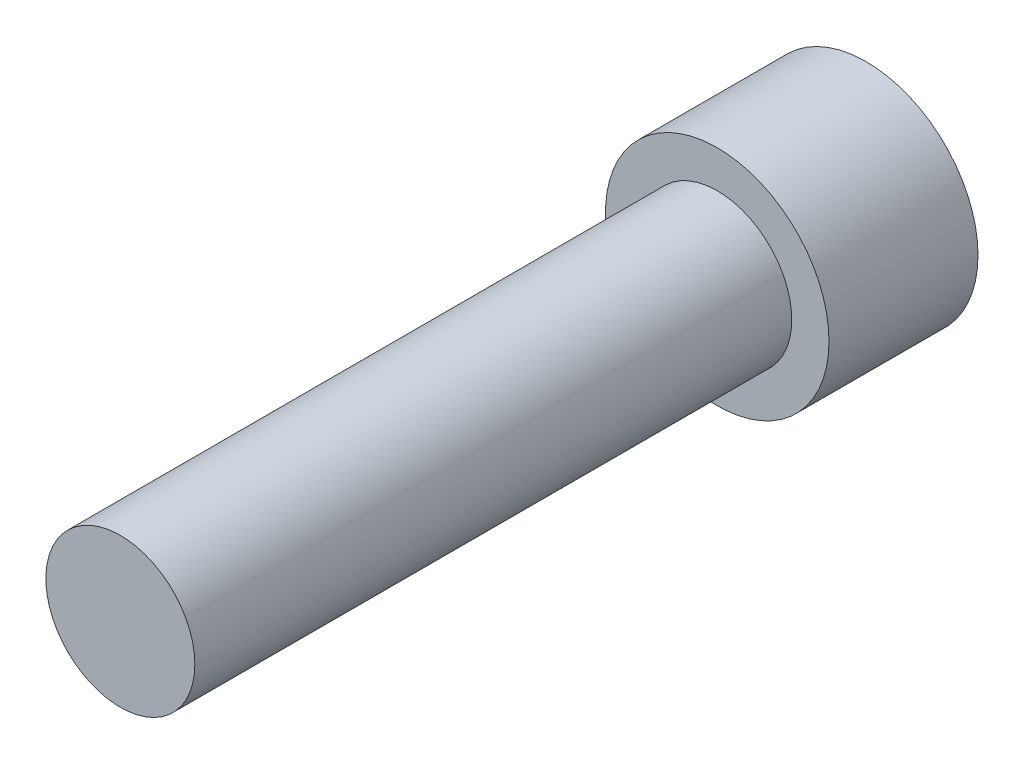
SolidWorks part; units mm, degrees
ref_plane "Front Plane" through (0, 0, 0) normal (0, 0, 1) x (1, 0, 0)
ref_plane "Top Plane" through (0, 0, 0) normal (0, 1, 0) x (1, 0, 0)
ref_plane "Right Plane" through (0, 0, 0) normal (1, 0, 0) x (0, 0, -1)
sketch "Sketch6" plane through (0, 0, 0) normal (1, 0, 0) x (0, 0, -1)
  line L0 (-31.75, 0) -> (22.525, 0) construction
  line L1 (6.538, 0) -> (-6.538, 0) construction
  line L2 (-31.75, 0) -> (-31.75, -3.9624)
  line L3 (-31.75, -3.9624) -> (0, -3.9624)
  line L4 (0, 6.538) -> (0, -6.538) construction
  line L5 (0, -3.9624) -> (0, -5.9436)
  line L6 (0, -5.9436) -> (7.9248, -5.9436)
  line L7 (7.9248, -5.9436) -> (7.9248, 0)
  line L8 (7.9248, 0) -> (-31.75, 0)
  dimension "L" = 31.75
  dimension "H" = 7.9248
  dimension "A" = 11.8872
  dimension "D" = 7.9248
revolve "Revolve1" add sketch "Sketch6" angle 360 about L0
sketch "Sketch7" plane through (0, 0, -7.9248) normal (0, 0, -1) x (-1, 0, 0)
  line L2 (-3.175, 1.8331) -> (-3.175, -1.8331)
  line L4 (-3.175, -1.8331) -> (0, -3.6662)
  line L5 (0, -3.6662) -> (3.175, -1.8331)
  line L6 (3.175, -1.8331) -> (3.175, 1.8331)
  line L7 (3.175, 1.8331) -> (0, 3.6662)
  line L8 (0, 3.6662) -> (-3.175, 1.8331)
  circle A0 centre (0, 0) radius 3.175 construction
  dimension "J" = 6.35
extrude "HEX" cut sketch "Sketch7" against normal blind 4.826
